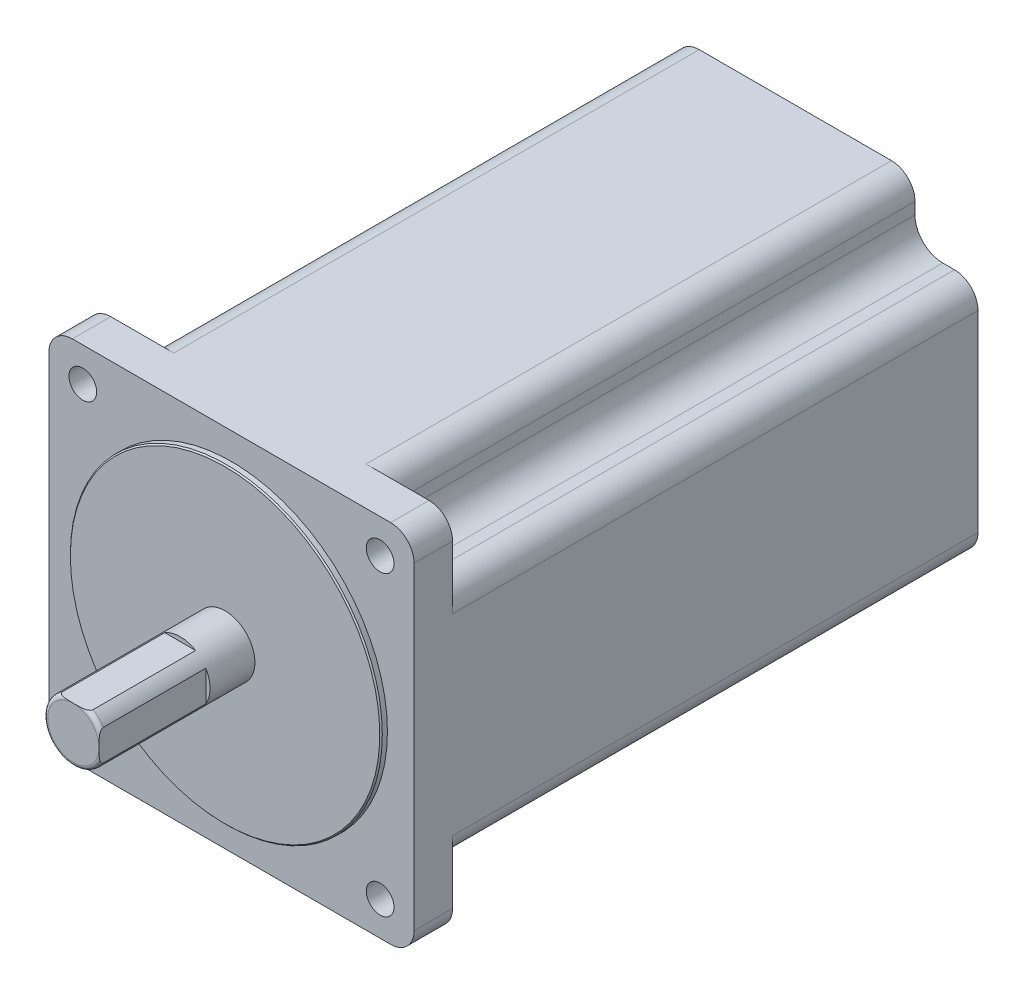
SolidWorks part; units mm, degrees
ref_plane "正面" through (0, 0, 0) normal (0, 0, 1) x (1, 0, 0)
ref_plane "平面" through (0, 0, 0) normal (0, 1, 0) x (1, 0, 0)
ref_plane "右側面" through (0, 0, 0) normal (1, 0, 0) x (0, 0, -1)
sketch "ｽｹｯﾁ1" plane through (0, 0, 0) normal (0, 0, 1) x (1, 0, 0)
  circle A0 centre (0, 0) radius 7
  dimension "D1" = 14
extrude "押し出し1" add sketch "ｽｹｯﾁ1" along normal blind 35.5
sketch "ｽｹｯﾁ2" plane through (0, 0, 0) normal (0, 0, -1) x (-1, 0, 0)
  circle A0 centre (0, 0) radius 36.5125
  dimension "D1" = 73.025
extrude "押し出し2" add sketch "ｽｹｯﾁ2" along normal blind 1.5
sketch "ｽｹｯﾁ3" plane through (0, 0, -1.5) normal (0, 0, -1) x (-1, 0, 0)
  line L1 (-42.75, 42.75) -> (42.75, 42.75)
  line L2 (-42.75, 42.75) -> (-42.75, -42.75)
  line L3 (-42.75, -42.75) -> (42.75, -42.75)
  line L4 (42.75, 42.75) -> (42.75, -42.75)
  line L5 (-42.75, 42.75) -> (42.75, -42.75) construction
  line L6 (-42.75, -42.75) -> (42.75, 42.75) construction
  line L7 (34.8, 34.8) -> (-34.8, 34.8) construction
  line L8 (34.8, 34.8) -> (34.8, -34.8) construction
  line L9 (34.8, -34.8) -> (-34.8, -34.8) construction
  line L10 (-34.8, 34.8) -> (-34.8, -34.8) construction
  line L11 (34.8, 34.8) -> (-34.8, -34.8) construction
  line L12 (34.8, -34.8) -> (-34.8, 34.8) construction
  circle A0 centre (34.8, 34.8) radius 3.25
  circle A1 centre (-34.8, 34.8) radius 3.25
  circle A2 centre (34.8, -34.8) radius 3.25
  circle A3 centre (-34.8, -34.8) radius 3.25
  point P0 (0, 0)
  point P6 (0, 0)
  dimension "D3" = 69.6
  dimension "D4" = 69.6
  dimension "D6" = 6.5
  dimension "D1" = 85.5
  dimension "D2" = 85.5
extrude "押し出し3" add sketch "ｽｹｯﾁ3" along normal blind 9
fillet "Fillet1" radius 5.5 4 edges at (42.75, -42.75, -6) (-42.75, -42.75, -6) (-42.75, 42.75, -6) (42.75, 42.75, -6)
sketch "ｽｹｯﾁ4" plane through (0, 0, -10.5) normal (0, 0, -1) x (-1, 0, 0)
  line L0 (28, 28) -> (42.75, 28)
  line L1 (-28, 42.75) -> (28, 42.75)
  line L2 (-28, 42.75) -> (-28, 28)
  line L3 (-28, -42.75) -> (28, -42.75)
  line L4 (28, 42.75) -> (28, 28)
  line L5 (-28, 42.75) -> (28, -42.75) construction
  line L6 (-28, -42.75) -> (28, 42.75) construction
  line L7 (-42.75, 28) -> (-28, 28)
  line L8 (-42.75, 28) -> (-42.75, -28)
  line L9 (-42.75, -28) -> (-28, -28)
  line L10 (42.75, 28) -> (42.75, -28)
  line L11 (-42.75, 28) -> (42.75, -28) construction
  line L12 (-42.75, -28) -> (42.75, 28) construction
  line L13 (-28, -28) -> (-28, -42.75)
  line L14 (28, -28) -> (42.75, -28)
  line L15 (28, -28) -> (28, -42.75)
  point P0 (0, 0)
  point P6 (0, 0)
  dimension "D1" = 56
  dimension "D2" = 85.5
  dimension "D3" = 85.5
  dimension "D4" = 56
extrude "押し出し4" add sketch "ｽｹｯﾁ4" along normal blind 123
fillet "Fillet2" radius 6.5 4 edges at (28, -28, -72) (-28, -28, -72) (-28, 28, -72) (28, 28, -72)
fillet "Fillet3" radius 5.5 8 edges
sketch "Sketch1" plane through (0, -42.75, 0) normal (0, -1, 0) x (1, 0, 0)
  line L0 (22.5, -133.5) -> (-22.5, -133.5) construction
  line L1 (-13.25, -133.5) -> (13.25, -133.5)
  line L2 (-13.25, -133.5) -> (-13.25, -112.5)
  line L3 (-13.25, -112.5) -> (13.25, -112.5)
  line L4 (13.25, -133.5) -> (13.25, -112.5)
  dimension "D1" = 21
  dimension "D2" = 26.5
  dimension "D3" = 13.25
extrude "Extrude1" add sketch "Sketch1" along normal blind 12
sketch "Sketch5" plane through (13.25, 0, 0) normal (1, 0, 0) x (0, 0, -1)
  line L0 (133.5, -47.75) -> (124.9, -54.75)
  line L3 (133.5, -54.75) -> (133.5, -42.75) construction
  line L4 (133.5, -54.75) -> (112.5, -54.75) construction
  line L6 (124.9, -54.75) -> (133.5, -54.75)
  line L8 (133.5, -54.75) -> (133.5, -47.75)
  dimension "D1" = 7
  dimension "D2" = 8.6
extrude "Extrude4" cut sketch "Sketch5" against normal through all and the other way through all
sketch "Sketch6" plane through (0, 0, -112.5) normal (0, 0, 1) x (1, 0, 0)
  line L0 (-13.25, -49.75) -> (-13.25, -54.75)
  line L2 (-13.25, -49.75) -> (-13.25, -54.75)
  line L3 (-13.25, -54.75) -> (-7.5, -54.75)
  line L4 (13.25, -54.75) -> (-13.25, -54.75) construction
  line L5 (-7.5, -54.75) -> (-13.25, -49.75)
  line L6 (13.25, -49.75) -> (13.25, -54.75)
  line L7 (13.25, -54.75) -> (13.25, -42.75) construction
  line L8 (13.25, -54.75) -> (7.5, -54.75)
  line L9 (7.5, -54.75) -> (13.25, -49.75)
  dimension "D1" = 5
  dimension "D2" = 7.5
  dimension "D3" = 15
  dimension "D4" = 5
extrude "Extrude5" cut sketch "Sketch6" against normal through all contours L5 M3 M2 | L9 M3 M4
fillet "Fillet4" radius 1 1 edges at (7, 0, 35.5)
sketch "Sketch2" plane through (0, 0, 35.5) normal (0, 0, 1) x (1, 0, 0)
  line L1 (-7, 8) -> (7, 8)
  line L2 (-7, 8) -> (-7, 6)
  line L3 (-7, 6) -> (7, 6)
  line L4 (7, 8) -> (7, 6)
  line L5 (8, -8) -> (6, -8)
  line L6 (8, -8) -> (8, 6)
  line L7 (8, 6) -> (6, 6)
  line L8 (6, -8) -> (6, 6)
  circle A0 centre (0, 0) radius 7 construction
  dimension "D1" = 6
  dimension "D2" = 14
  dimension "D3" = 2
  dimension "D4" = 7
  dimension "D5" = 6
  dimension "D6" = 2
  dimension "D7" = 14
extrude "Extrude2" cut sketch "Sketch2" against normal blind 25 contours L4 L1 L2 L3 | L6 L7 L8 L5
chamfer "Chamfer2" distance 0.3 angle 45 1 edges at (-36.5125, 0, 0)
sketch "Sketch3" plane through (0, 0, -1.5) normal (0, 0, 1) x (1, 0, 0)
  circle A0 centre (0, 0) radius 18
  circle A1 centre (0, 0) radius 24.35
  dimension "D1" = 48.7
  dimension "D2" = 36
extrude "Extrude3" cut sketch "Sketch3" against normal blind 0.2
chamfer "Chamfer3" distance 0.2 distance2 0.4 1 edges at (24.35, 0, -1.7)
